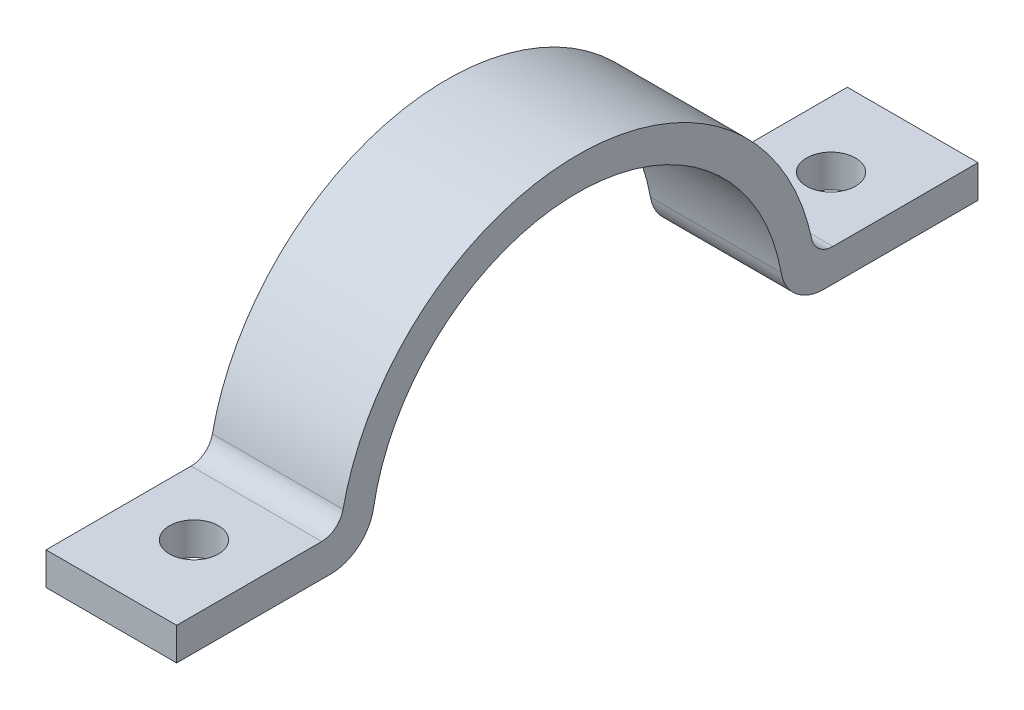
SolidWorks part; units mm, degrees
ref_plane "Front Plane" through (0, 0, 0) normal (0, 0, 1) x (1, 0, 0)
ref_plane "Top Plane" through (0, 0, 0) normal (0, 1, 0) x (1, 0, 0)
ref_plane "Right Plane" through (0, 0, 0) normal (1, 0, 0) x (0, 0, -1)
sketch "Sketch1" plane through (0, 0, 0) normal (1, 0, 0) x (0, 0, -1)
  line L0 (-20, 0) -> (20, 0) construction
  line L1 (19, 0) -> (36.7945, 0)
  line L2 (36.7945, 0) -> (36.7945, 3)
  line L3 (36.7945, 3) -> (21.7945, 3)
  line L4 (-19, 0) -> (-36.7945, 0)
  line L5 (-36.7945, 0) -> (-36.7945, 3)
  line L6 (-36.7945, 3) -> (-21.7945, 3)
  arc A0 (-20, 0) -> (20, 0) centre (0, 0) cw construction
  arc A1 (-19, 0) -> (19, 0) centre (0, 0) cw
  arc A2 (-21.7945, 3) -> (21.7945, 3) centre (0, 0) cw
  arc A3 (-22, 0) -> (22, 0) centre (0, 0) cw construction
  point P4 (0, 0)
  dimension "D1" = 40
  dimension "D4" = 3
  dimension "D5" = 3
  dimension "D6" = 15
  dimension "D7" = 15
  dimension "D2" = 1
  dimension "D3" = 2
extrude "Boss-Extrude1" add sketch "Sketch1" along normal blind 12
sketch "Sketch2" plane through (0, 3, 0) normal (0, 1, 0) x (1, 0, 0)
  line L0 (6, 36.7945) -> (6, 21.7945) construction
  line L1 (12, 36.7945) -> (0, 36.7945) construction
  line L2 (12, 21.7945) -> (0, 21.7945) construction
  circle A0 centre (6, 29.2945) radius 2.25
  point P11 (6, 29.2945)
  dimension "D1" = 4.5
extrude "Cut-Extrude1" cut sketch "Sketch2" against normal through all
pattern_linear "LPattern1" count 2 spacing 58.5 along (0, 0, 1) of "Cut-Extrude1"
fillet "Fillet1" radius 4 2 edges at (6, 0, 19) (6, 0, -19)
fillet "Fillet2" radius 2 2 edges at (6, 3, 21.7945) (6, 3, -21.7945)
